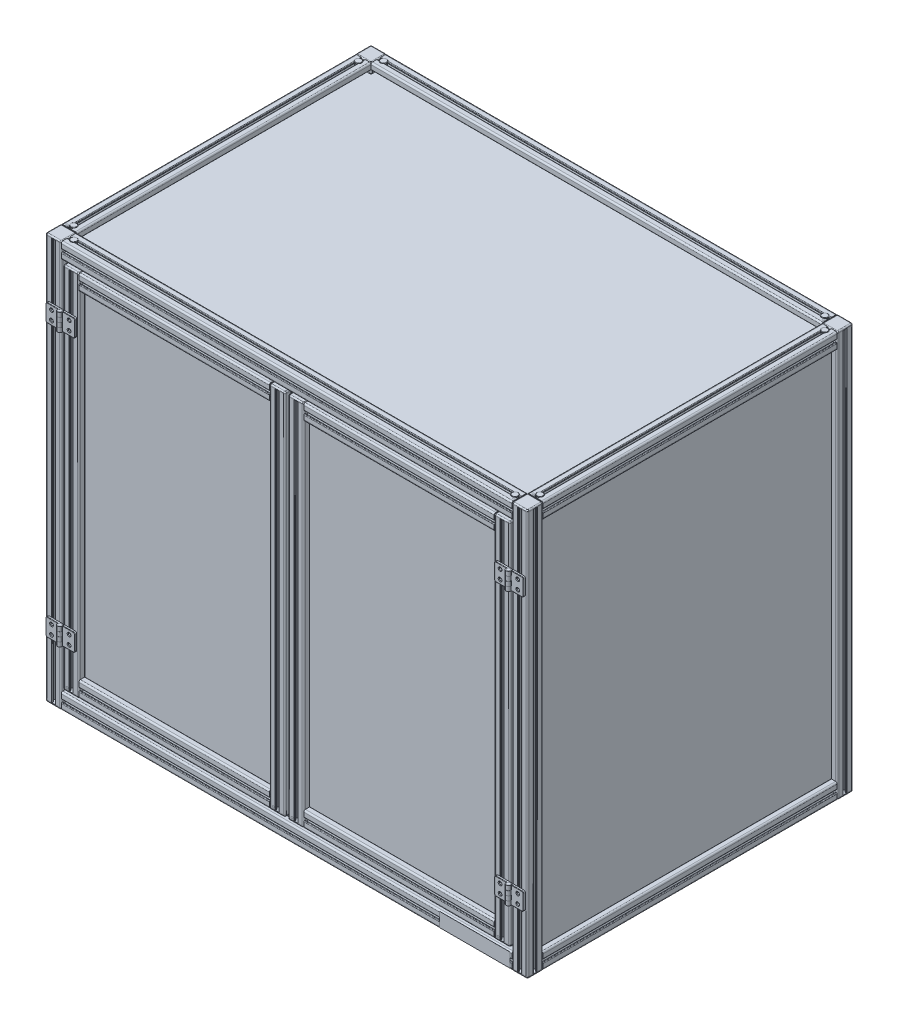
SolidWorks part; units mm, degrees
other "<202501-0001 _Schutzzaun Roboterzelle V2 D>-<202501-0001 _Schutzzaun Roboterzelle V2 D.STEP-1/Kopie (2) von Profil 8 40x40 leicht natur^SW049037_ZV-A _ ZV-A.STEP-1/Kopie von AS0041460^Kopie (2) von Pr"
other "<202501-0001 _Schutzzaun Roboterzelle V2 D>-<202501-0001 _Schutzzaun Roboterzelle V2 D.STEP-1/Kopie (2) von Profil 8 40x40 leicht natur^SW049037_ZV-A _ ZV-A.STEP-1/Kopie von AS0041460^Kopie (2) von Pr"
other "<202501-0001 _Schutzzaun Roboterzelle V2 D>-<202501-0001 _Schutzzaun Roboterzelle V2 D.STEP-1/Kopie (2) von Profil 8 40x40 leicht natur^SW049037_ZV-A _ ZV-A.STEP-1/Kopie von AS0041460^Kopie (2) von Pr"
other "<202501-0001 _Schutzzaun Roboterzelle V2 D>-<202501-0001 _Schutzzaun Roboterzelle V2 D.STEP-1/Kopie (2) von Profil 8 40x40 leicht natur^SW049037_ZV-A _ ZV-A.STEP-1/Kopie von AS0041460^Kopie (2) von Pr"
other "<202501-0001 _Schutzzaun Roboterzelle V2 D>-<202501-0001 _Schutzzaun Roboterzelle V2 D.STEP-1/Kopie (2) von Profil 8 40x40 leicht natur^SW049037_ZV-A _ ZV-A.STEP-1/Kopie von AS0041460^Kopie (2) von Pr"
other "<202501-0001 _Schutzzaun Roboterzelle V2 D>-<202501-0001 _Schutzzaun Roboterzelle V2 D.STEP-1/Kopie (2) von Profil 8 40x40 leicht natur^SW049037_ZV-A _ ZV-A.STEP-1/Profil 8 40x40 leicht natur^Kopie (2"
other "<202501-0001 _Schutzzaun Roboterzelle V2 D>-<202501-0001 _Schutzzaun Roboterzelle V2 D.STEP-1/Kopie von Profil 8 40x40 leicht natur^SW049037_-- _ --.STEP-4/Profil 8 40x40 leicht natur^Kopie von Profil"
other "<202501-0001 _Schutzzaun Roboterzelle V2 D>-<202501-0001 _Schutzzaun Roboterzelle V2 D.STEP-1/Kopie von Profil 8 40x40 leicht natur^SW049037_-- _ --.STEP-3/Profil 8 40x40 leicht natur^Kopie von Profil"
other "<202501-0001 _Schutzzaun Roboterzelle V2 D>-<202501-0001 _Schutzzaun Roboterzelle V2 D.STEP-1/Kopie von Profil 8 40x40 leicht natur^SW049037_-- _ --.STEP-2/Profil 8 40x40 leicht natur^Kopie von Profil"
other "<202501-0001 _Schutzzaun Roboterzelle V2 D>-<202501-0001 _Schutzzaun Roboterzelle V2 D.STEP-1/Kopie von Profil 8 40x40 leicht natur^SW049037_-- _ --.STEP-1/Profil 8 40x40 leicht natur^Kopie von Profil"
other "<202501-0001 _Schutzzaun Roboterzelle V2 D>-<202501-0001 _Schutzzaun Roboterzelle V2 D.STEP-1/Kopie (2) von Profil 8 40x40 leicht natur^SW049037_ZV-A _ ZV-A.STEP-3/Kopie von AS0041460^Kopie (2) von Pr"
other "<202501-0001 _Schutzzaun Roboterzelle V2 D>-<202501-0001 _Schutzzaun Roboterzelle V2 D.STEP-1/Kopie (2) von Profil 8 40x40 leicht natur^SW049037_ZV-A _ ZV-A.STEP-3/Kopie von AS0041460^Kopie (2) von Pr"
other "<202501-0001 _Schutzzaun Roboterzelle V2 D>-<202501-0001 _Schutzzaun Roboterzelle V2 D.STEP-1/Kopie (2) von Profil 8 40x40 leicht natur^SW049037_ZV-A _ ZV-A.STEP-3/Kopie von AS0041460^Kopie (2) von Pr"
other "<202501-0001 _Schutzzaun Roboterzelle V2 D>-<202501-0001 _Schutzzaun Roboterzelle V2 D.STEP-1/Kopie (2) von Profil 8 40x40 leicht natur^SW049037_ZV-A _ ZV-A.STEP-3/Profil 8 40x40 leicht natur^Kopie (2"
other "<202501-0001 _Schutzzaun Roboterzelle V2 D>-<202501-0001 _Schutzzaun Roboterzelle V2 D.STEP-1/Kopie (2) von Profil 8 40x40 leicht natur^SW049037_ZV-A _ ZV-A.STEP-2/Kopie von AS0041460^Kopie (2) von Pr"
other "<202501-0001 _Schutzzaun Roboterzelle V2 D>-<202501-0001 _Schutzzaun Roboterzelle V2 D.STEP-1/Kopie (2) von Profil 8 40x40 leicht natur^SW049037_ZV-A _ ZV-A.STEP-2/Kopie von AS0041460^Kopie (2) von Pr"
other "<202501-0001 _Schutzzaun Roboterzelle V2 D>-<202501-0001 _Schutzzaun Roboterzelle V2 D.STEP-1/Kopie (2) von Profil 8 40x40 leicht natur^SW049037_ZV-A _ ZV-A.STEP-2/Kopie von AS0041460^Kopie (2) von Pr"
other "<202501-0001 _Schutzzaun Roboterzelle V2 D>-<202501-0001 _Schutzzaun Roboterzelle V2 D.STEP-1/Kopie (2) von Profil 8 40x40 leicht natur^SW049037_ZV-A _ ZV-A.STEP-2/Kopie von AS0041460^Kopie (2) von Pr"
other "<202501-0001 _Schutzzaun Roboterzelle V2 D>-<202501-0001 _Schutzzaun Roboterzelle V2 D.STEP-1/Kopie (2) von Profil 8 40x40 leicht natur^SW049037_ZV-A _ ZV-A.STEP-2/Kopie von AS0041460^Kopie (2) von Pr"
other "<202501-0001 _Schutzzaun Roboterzelle V2 D>-<202501-0001 _Schutzzaun Roboterzelle V2 D.STEP-1/Kopie (2) von Profil 8 40x40 leicht natur^SW049037_ZV-A _ ZV-A.STEP-2/Kopie von AS0041460^Kopie (2) von Pr"
other "<202501-0001 _Schutzzaun Roboterzelle V2 D>-<202501-0001 _Schutzzaun Roboterzelle V2 D.STEP-1/Kopie (2) von Profil 8 40x40 leicht natur^SW049037_ZV-A _ ZV-A.STEP-2/Kopie von AS0041460^Kopie (2) von Pr"
other "<202501-0001 _Schutzzaun Roboterzelle V2 D>-<202501-0001 _Schutzzaun Roboterzelle V2 D.STEP-1/Kopie (2) von Profil 8 40x40 leicht natur^SW049037_ZV-A _ ZV-A.STEP-2/Kopie von AS0041460^Kopie (2) von Pr"
other "<202501-0001 _Schutzzaun Roboterzelle V2 D>-<202501-0001 _Schutzzaun Roboterzelle V2 D.STEP-1/Kopie (2) von Profil 8 40x40 leicht natur^SW049037_ZV-A _ ZV-A.STEP-2/Profil 8 40x40 leicht natur^Kopie (2"
other "<202501-0001 _Schutzzaun Roboterzelle V2 D>-<202501-0001 _Schutzzaun Roboterzelle V2 D.STEP-1/Kopie (2) von Profil 8 40x40 leicht natur^SW049037_ZV-A _ ZV-A.STEP-1/Kopie von AS0041460^Kopie (2) von Pr"
other "<202501-0001 _Schutzzaun Roboterzelle V2 D>-<202501-0001 _Schutzzaun Roboterzelle V2 D.STEP-1/Kopie (2) von Profil 8 40x40 leicht natur^SW049037_ZV-A _ ZV-A.STEP-1/Kopie von AS0041460^Kopie (2) von Pr"
other "<202501-0001 _Schutzzaun Roboterzelle V2 D>-<202501-0001 _Schutzzaun Roboterzelle V2 D.STEP-1/Kopie (2) von Profil 8 40x40 leicht natur^SW049037_ZV-A _ ZV-A.STEP-1/Kopie von AS0041460^Kopie (2) von Pr"
other "<202501-0001 _Schutzzaun Roboterzelle V2 D>-<202501-0001 _Schutzzaun Roboterzelle V2 D.STEP-1/Kopie (3) von Profil 8 40x40 leicht natur^SW049037_ZV-A _ ZV-A.STEP-1/Kopie von AS0041460^Kopie (3) von Pr"
other "<202501-0001 _Schutzzaun Roboterzelle V2 D>-<202501-0001 _Schutzzaun Roboterzelle V2 D.STEP-1/Kopie (3) von Profil 8 40x40 leicht natur^SW049037_ZV-A _ ZV-A.STEP-1/Profil 8 40x40 leicht natur^Kopie (3"
other "<202501-0001 _Schutzzaun Roboterzelle V2 D>-<202501-0001 _Schutzzaun Roboterzelle V2 D.STEP-1/Kopie (2) von Profil 8 40x40 leicht natur^SW049037_ZV-A _ ZV-A.STEP-4/Kopie von AS0041460^Kopie (2) von Pr"
other "<202501-0001 _Schutzzaun Roboterzelle V2 D>-<202501-0001 _Schutzzaun Roboterzelle V2 D.STEP-1/Kopie (2) von Profil 8 40x40 leicht natur^SW049037_ZV-A _ ZV-A.STEP-4/Kopie von AS0041460^Kopie (2) von Pr"
other "<202501-0001 _Schutzzaun Roboterzelle V2 D>-<202501-0001 _Schutzzaun Roboterzelle V2 D.STEP-1/Kopie (2) von Profil 8 40x40 leicht natur^SW049037_ZV-A _ ZV-A.STEP-4/Kopie von AS0041460^Kopie (2) von Pr"
other "<202501-0001 _Schutzzaun Roboterzelle V2 D>-<202501-0001 _Schutzzaun Roboterzelle V2 D.STEP-1/Kopie (2) von Profil 8 40x40 leicht natur^SW049037_ZV-A _ ZV-A.STEP-4/Kopie von AS0041460^Kopie (2) von Pr"
other "<202501-0001 _Schutzzaun Roboterzelle V2 D>-<202501-0001 _Schutzzaun Roboterzelle V2 D.STEP-1/Kopie (2) von Profil 8 40x40 leicht natur^SW049037_ZV-A _ ZV-A.STEP-4/Kopie von AS0041460^Kopie (2) von Pr"
other "<202501-0001 _Schutzzaun Roboterzelle V2 D>-<202501-0001 _Schutzzaun Roboterzelle V2 D.STEP-1/Kopie (2) von Profil 8 40x40 leicht natur^SW049037_ZV-A _ ZV-A.STEP-4/Kopie von AS0041460^Kopie (2) von Pr"
other "<202501-0001 _Schutzzaun Roboterzelle V2 D>-<202501-0001 _Schutzzaun Roboterzelle V2 D.STEP-1/Kopie (2) von Profil 8 40x40 leicht natur^SW049037_ZV-A _ ZV-A.STEP-4/Kopie von AS0041460^Kopie (2) von Pr"
other "<202501-0001 _Schutzzaun Roboterzelle V2 D>-<202501-0001 _Schutzzaun Roboterzelle V2 D.STEP-1/Kopie (2) von Profil 8 40x40 leicht natur^SW049037_ZV-A _ ZV-A.STEP-4/Kopie von AS0041460^Kopie (2) von Pr"
other "<202501-0001 _Schutzzaun Roboterzelle V2 D>-<202501-0001 _Schutzzaun Roboterzelle V2 D.STEP-1/Kopie (2) von Profil 8 40x40 leicht natur^SW049037_ZV-A _ ZV-A.STEP-4/Profil 8 40x40 leicht natur^Kopie (2"
other "<202501-0001 _Schutzzaun Roboterzelle V2 D>-<202501-0001 _Schutzzaun Roboterzelle V2 D.STEP-1/Kopie (2) von Profil 8 40x40 leicht natur^SW049037_ZV-A _ ZV-A.STEP-3/Kopie von AS0041460^Kopie (2) von Pr"
other "<202501-0001 _Schutzzaun Roboterzelle V2 D>-<202501-0001 _Schutzzaun Roboterzelle V2 D.STEP-1/Kopie (2) von Profil 8 40x40 leicht natur^SW049037_ZV-A _ ZV-A.STEP-3/Kopie von AS0041460^Kopie (2) von Pr"
other "<202501-0001 _Schutzzaun Roboterzelle V2 D>-<202501-0001 _Schutzzaun Roboterzelle V2 D.STEP-1/Kopie (2) von Profil 8 40x40 leicht natur^SW049037_ZV-A _ ZV-A.STEP-3/Kopie von AS0041460^Kopie (2) von Pr"
other "<202501-0001 _Schutzzaun Roboterzelle V2 D>-<202501-0001 _Schutzzaun Roboterzelle V2 D.STEP-1/Kopie (2) von Profil 8 40x40 leicht natur^SW049037_ZV-A _ ZV-A.STEP-3/Kopie von AS0041460^Kopie (2) von Pr"
other "<202501-0001 _Schutzzaun Roboterzelle V2 D>-<202501-0001 _Schutzzaun Roboterzelle V2 D.STEP-1/Kopie (2) von Profil 8 40x40 leicht natur^SW049037_ZV-A _ ZV-A.STEP-3/Kopie von AS0041460^Kopie (2) von Pr"
other "<202501-0001 _Schutzzaun Roboterzelle V2 D>-<202501-0001 _Schutzzaun Roboterzelle V2 D.STEP-1/Kopie (3) von Profil 8 40x40 leicht natur^SW049037_ZV-A _ ZV-A.STEP-2/Kopie von AS0041460^Kopie (3) von Pr"
other "<202501-0001 _Schutzzaun Roboterzelle V2 D>-<202501-0001 _Schutzzaun Roboterzelle V2 D.STEP-1/Kopie (3) von Profil 8 40x40 leicht natur^SW049037_ZV-A _ ZV-A.STEP-2/Kopie von AS0041460^Kopie (3) von Pr"
other "<202501-0001 _Schutzzaun Roboterzelle V2 D>-<202501-0001 _Schutzzaun Roboterzelle V2 D.STEP-1/Kopie (3) von Profil 8 40x40 leicht natur^SW049037_ZV-A _ ZV-A.STEP-2/Kopie von AS0041460^Kopie (3) von Pr"
other "<202501-0001 _Schutzzaun Roboterzelle V2 D>-<202501-0001 _Schutzzaun Roboterzelle V2 D.STEP-1/Kopie (3) von Profil 8 40x40 leicht natur^SW049037_ZV-A _ ZV-A.STEP-2/Kopie von AS0041460^Kopie (3) von Pr"
other "<202501-0001 _Schutzzaun Roboterzelle V2 D>-<202501-0001 _Schutzzaun Roboterzelle V2 D.STEP-1/Kopie (3) von Profil 8 40x40 leicht natur^SW049037_ZV-A _ ZV-A.STEP-2/Kopie von AS0041460^Kopie (3) von Pr"
other "<202501-0001 _Schutzzaun Roboterzelle V2 D>-<202501-0001 _Schutzzaun Roboterzelle V2 D.STEP-1/Kopie (3) von Profil 8 40x40 leicht natur^SW049037_ZV-A _ ZV-A.STEP-2/Kopie von AS0041460^Kopie (3) von Pr"
other "<202501-0001 _Schutzzaun Roboterzelle V2 D>-<202501-0001 _Schutzzaun Roboterzelle V2 D.STEP-1/Kopie (3) von Profil 8 40x40 leicht natur^SW049037_ZV-A _ ZV-A.STEP-2/Kopie von AS0041460^Kopie (3) von Pr"
other "<202501-0001 _Schutzzaun Roboterzelle V2 D>-<202501-0001 _Schutzzaun Roboterzelle V2 D.STEP-1/Kopie (3) von Profil 8 40x40 leicht natur^SW049037_ZV-A _ ZV-A.STEP-2/Kopie von AS0041460^Kopie (3) von Pr"
other "<202501-0001 _Schutzzaun Roboterzelle V2 D>-<202501-0001 _Schutzzaun Roboterzelle V2 D.STEP-1/Kopie (3) von Profil 8 40x40 leicht natur^SW049037_ZV-A _ ZV-A.STEP-2/Profil 8 40x40 leicht natur^Kopie (3"
other "<202501-0001 _Schutzzaun Roboterzelle V2 D>-<202501-0001 _Schutzzaun Roboterzelle V2 D.STEP-1/Kopie (3) von Profil 8 40x40 leicht natur^SW049037_ZV-A _ ZV-A.STEP-1/Kopie von AS0041460^Kopie (3) von Pr"
other "<202501-0001 _Schutzzaun Roboterzelle V2 D>-<202501-0001 _Schutzzaun Roboterzelle V2 D.STEP-1/Kopie (3) von Profil 8 40x40 leicht natur^SW049037_ZV-A _ ZV-A.STEP-1/Kopie von AS0041460^Kopie (3) von Pr"
other "<202501-0001 _Schutzzaun Roboterzelle V2 D>-<202501-0001 _Schutzzaun Roboterzelle V2 D.STEP-1/Kopie (3) von Profil 8 40x40 leicht natur^SW049037_ZV-A _ ZV-A.STEP-1/Kopie von AS0041460^Kopie (3) von Pr"
other "<202501-0001 _Schutzzaun Roboterzelle V2 D>-<202501-0001 _Schutzzaun Roboterzelle V2 D.STEP-1/Kopie (3) von Profil 8 40x40 leicht natur^SW049037_ZV-A _ ZV-A.STEP-1/Kopie von AS0041460^Kopie (3) von Pr"
other "<202501-0001 _Schutzzaun Roboterzelle V2 D>-<202501-0001 _Schutzzaun Roboterzelle V2 D.STEP-1/Kopie (3) von Profil 8 40x40 leicht natur^SW049037_ZV-A _ ZV-A.STEP-1/Kopie von AS0041460^Kopie (3) von Pr"
other "<202501-0001 _Schutzzaun Roboterzelle V2 D>-<202501-0001 _Schutzzaun Roboterzelle V2 D.STEP-1/Kopie (3) von Profil 8 40x40 leicht natur^SW049037_ZV-A _ ZV-A.STEP-1/Kopie von AS0041460^Kopie (3) von Pr"
other "<202501-0001 _Schutzzaun Roboterzelle V2 D>-<202501-0001 _Schutzzaun Roboterzelle V2 D.STEP-1/Kopie (3) von Profil 8 40x40 leicht natur^SW049037_ZV-A _ ZV-A.STEP-1/Kopie von AS0041460^Kopie (3) von Pr"
other "<202501-0001 _Schutzzaun Roboterzelle V2 D>-<202501-0001 _Schutzzaun Roboterzelle V2 D.STEP-1/Kopie (3) von Profil 8 40x40 leicht natur^SW049037_ZV-A _ ZV-A.STEP-4/Kopie von AS0041460^Kopie (3) von Pr"
other "<202501-0001 _Schutzzaun Roboterzelle V2 D>-<202501-0001 _Schutzzaun Roboterzelle V2 D.STEP-1/Kopie (3) von Profil 8 40x40 leicht natur^SW049037_ZV-A _ ZV-A.STEP-4/Kopie von AS0041460^Kopie (3) von Pr"
other "<202501-0001 _Schutzzaun Roboterzelle V2 D>-<202501-0001 _Schutzzaun Roboterzelle V2 D.STEP-1/Kopie (3) von Profil 8 40x40 leicht natur^SW049037_ZV-A _ ZV-A.STEP-4/Kopie von AS0041460^Kopie (3) von Pr"
other "<202501-0001 _Schutzzaun Roboterzelle V2 D>-<202501-0001 _Schutzzaun Roboterzelle V2 D.STEP-1/Kopie (3) von Profil 8 40x40 leicht natur^SW049037_ZV-A _ ZV-A.STEP-4/Kopie von AS0041460^Kopie (3) von Pr"
other "<202501-0001 _Schutzzaun Roboterzelle V2 D>-<202501-0001 _Schutzzaun Roboterzelle V2 D.STEP-1/Kopie (3) von Profil 8 40x40 leicht natur^SW049037_ZV-A _ ZV-A.STEP-4/Kopie von AS0041460^Kopie (3) von Pr"
other "<202501-0001 _Schutzzaun Roboterzelle V2 D>-<202501-0001 _Schutzzaun Roboterzelle V2 D.STEP-1/Kopie (3) von Profil 8 40x40 leicht natur^SW049037_ZV-A _ ZV-A.STEP-4/Kopie von AS0041460^Kopie (3) von Pr"
other "<202501-0001 _Schutzzaun Roboterzelle V2 D>-<202501-0001 _Schutzzaun Roboterzelle V2 D.STEP-1/Kopie (3) von Profil 8 40x40 leicht natur^SW049037_ZV-A _ ZV-A.STEP-4/Profil 8 40x40 leicht natur^Kopie (3"
other "<202501-0001 _Schutzzaun Roboterzelle V2 D>-<202501-0001 _Schutzzaun Roboterzelle V2 D.STEP-1/Kopie (3) von Profil 8 40x40 leicht natur^SW049037_ZV-A _ ZV-A.STEP-3/Kopie von AS0041460^Kopie (3) von Pr"
other "<202501-0001 _Schutzzaun Roboterzelle V2 D>-<202501-0001 _Schutzzaun Roboterzelle V2 D.STEP-1/Kopie (3) von Profil 8 40x40 leicht natur^SW049037_ZV-A _ ZV-A.STEP-3/Kopie von AS0041460^Kopie (3) von Pr"
other "<202501-0001 _Schutzzaun Roboterzelle V2 D>-<202501-0001 _Schutzzaun Roboterzelle V2 D.STEP-1/Kopie (3) von Profil 8 40x40 leicht natur^SW049037_ZV-A _ ZV-A.STEP-3/Kopie von AS0041460^Kopie (3) von Pr"
other "<202501-0001 _Schutzzaun Roboterzelle V2 D>-<202501-0001 _Schutzzaun Roboterzelle V2 D.STEP-1/Kopie (3) von Profil 8 40x40 leicht natur^SW049037_ZV-A _ ZV-A.STEP-3/Kopie von AS0041460^Kopie (3) von Pr"
other "<202501-0001 _Schutzzaun Roboterzelle V2 D>-<202501-0001 _Schutzzaun Roboterzelle V2 D.STEP-1/Kopie (3) von Profil 8 40x40 leicht natur^SW049037_ZV-A _ ZV-A.STEP-3/Kopie von AS0041460^Kopie (3) von Pr"
other "<202501-0001 _Schutzzaun Roboterzelle V2 D>-<202501-0001 _Schutzzaun Roboterzelle V2 D.STEP-1/Kopie (3) von Profil 8 40x40 leicht natur^SW049037_ZV-A _ ZV-A.STEP-3/Kopie von AS0041460^Kopie (3) von Pr"
other "<202501-0001 _Schutzzaun Roboterzelle V2 D>-<202501-0001 _Schutzzaun Roboterzelle V2 D.STEP-1/Kopie (3) von Profil 8 40x40 leicht natur^SW049037_ZV-A _ ZV-A.STEP-3/Kopie von AS0041460^Kopie (3) von Pr"
other "<202501-0001 _Schutzzaun Roboterzelle V2 D>-<202501-0001 _Schutzzaun Roboterzelle V2 D.STEP-1/Kopie (3) von Profil 8 40x40 leicht natur^SW049037_ZV-A _ ZV-A.STEP-3/Kopie von AS0041460^Kopie (3) von Pr"
other "<202501-0001 _Schutzzaun Roboterzelle V2 D>-<202501-0001 _Schutzzaun Roboterzelle V2 D.STEP-1/Kopie (3) von Profil 8 40x40 leicht natur^SW049037_ZV-A _ ZV-A.STEP-3/Profil 8 40x40 leicht natur^Kopie (3"
other "<202501-0001 _Schutzzaun Roboterzelle V2 D>-<202501-0001 _Schutzzaun Roboterzelle V2 D.STEP-1/Abdeckkappen_PB08 - 08 - 40x40 (40015) s.STEP-14/Abdeckkappen_PB08 - 08 - 40x40 (40015) s-0.STEP-1-solid1>"
other "<202501-0001 _Schutzzaun Roboterzelle V2 D>-<202501-0001 _Schutzzaun Roboterzelle V2 D.STEP-1/Abdeckkappen_PB08 - 08 - 40x40 (40015) s.STEP-13/Abdeckkappen_PB08 - 08 - 40x40 (40015) s-0.STEP-1-solid1>"
other "<202501-0001 _Schutzzaun Roboterzelle V2 D>-<202501-0001 _Schutzzaun Roboterzelle V2 D.STEP-1/Abdeckkappen_PB08 - 08 - 40x40 (40015) s.STEP-12/Abdeckkappen_PB08 - 08 - 40x40 (40015) s-0.STEP-1-solid1>"
other "<202501-0001 _Schutzzaun Roboterzelle V2 D>-<202501-0001 _Schutzzaun Roboterzelle V2 D.STEP-1/Abdeckkappen_PB08 - 08 - 40x40 (40015) s.STEP-11/Abdeckkappen_PB08 - 08 - 40x40 (40015) s-0.STEP-1-solid1>"
other "<202501-0001 _Schutzzaun Roboterzelle V2 D>-<202501-0001 _Schutzzaun Roboterzelle V2 D.STEP-1/Abdeckkappen_PB08 - 08 - 40x40 (40015) s.STEP-10/Abdeckkappen_PB08 - 08 - 40x40 (40015) s-0.STEP-1-solid1>"
other "<202501-0001 _Schutzzaun Roboterzelle V2 D>-<202501-0001 _Schutzzaun Roboterzelle V2 D.STEP-1/Abdeckkappen_PB08 - 08 - 40x40 (40015) s.STEP-9/Abdeckkappen_PB08 - 08 - 40x40 (40015) s-0.STEP-1-solid1>"
other "<202501-0001 _Schutzzaun Roboterzelle V2 D>-<202501-0001 _Schutzzaun Roboterzelle V2 D.STEP-1/Abdeckkappen_PB08 - 08 - 40x40 (40015) s.STEP-8/Abdeckkappen_PB08 - 08 - 40x40 (40015) s-0.STEP-1-solid1>"
other "<202501-0001 _Schutzzaun Roboterzelle V2 D>-<202501-0001 _Schutzzaun Roboterzelle V2 D.STEP-1/Abdeckkappen_PB08 - 08 - 40x40 (40015) s.STEP-7/Abdeckkappen_PB08 - 08 - 40x40 (40015) s-0.STEP-1-solid1>"
other "<202501-0001 _Schutzzaun Roboterzelle V2 D>-<202501-0001 _Schutzzaun Roboterzelle V2 D.STEP-1/Abdeckkappen_PB08 - 08 - 40x40 (40015) s.STEP-6/Abdeckkappen_PB08 - 08 - 40x40 (40015) s-0.STEP-1-solid1>"
other "<202501-0001 _Schutzzaun Roboterzelle V2 D>-<202501-0001 _Schutzzaun Roboterzelle V2 D.STEP-1/Abdeckkappen_PB08 - 08 - 40x40 (40015) s.STEP-5/Abdeckkappen_PB08 - 08 - 40x40 (40015) s-0.STEP-1-solid1>"
other "<202501-0001 _Schutzzaun Roboterzelle V2 D>-<202501-0001 _Schutzzaun Roboterzelle V2 D.STEP-1/Abdeckkappen_PB08 - 08 - 40x40 (40015) s.STEP-4/Abdeckkappen_PB08 - 08 - 40x40 (40015) s-0.STEP-1-solid1>"
other "<202501-0001 _Schutzzaun Roboterzelle V2 D>-<202501-0001 _Schutzzaun Roboterzelle V2 D.STEP-1/Abdeckkappen_PB08 - 08 - 40x40 (40015) s.STEP-3/Abdeckkappen_PB08 - 08 - 40x40 (40015) s-0.STEP-1-solid1>"
other "<202501-0001 _Schutzzaun Roboterzelle V2 D>-<202501-0001 _Schutzzaun Roboterzelle V2 D.STEP-1/Abdeckkappen_PB08 - 08 - 40x40 (40015) s.STEP-2/Abdeckkappen_PB08 - 08 - 40x40 (40015) s-0.STEP-1-solid1>"
other "<202501-0001 _Schutzzaun Roboterzelle V2 D>-<202501-0001 _Schutzzaun Roboterzelle V2 D.STEP-1/Abdeckkappen_PB08 - 08 - 40x40 (40015) s.STEP-1/Abdeckkappen_PB08 - 08 - 40x40 (40015) s-0.STEP-1-solid1>"
other "<202501-0001 _Schutzzaun Roboterzelle V2 D>-<202501-0001 _Schutzzaun Roboterzelle V2 D.STEP-1/Kopie (3) von Profil 8 40x40 leicht natur^SW049037_ZV-A _ ZV-A.STEP-4/Kopie von AS0041460^Kopie (3) von Pr"
other "<202501-0001 _Schutzzaun Roboterzelle V2 D>-<202501-0001 _Schutzzaun Roboterzelle V2 D.STEP-1/Kopie (3) von Profil 8 40x40 leicht natur^SW049037_ZV-A _ ZV-A.STEP-4/Kopie von AS0041460^Kopie (3) von Pr"
other "<202501-0001 _Schutzzaun Roboterzelle V2 D>-<202501-0001 _Schutzzaun Roboterzelle V2 D.STEP-1/Kopie (5) von Profil 8 40x40 leicht natur^SW049037_ZV-A _ ZV-A.STEP-2/Profil 8 40x40 leicht natur^Kopie (5"
other "<202501-0001 _Schutzzaun Roboterzelle V2 D>-<202501-0001 _Schutzzaun Roboterzelle V2 D.STEP-1/Kopie (5) von Profil 8 40x40 leicht natur^SW049037_ZV-A _ ZV-A.STEP-1/Kopie von AS0041460^Kopie (5) von Pr"
other "<202501-0001 _Schutzzaun Roboterzelle V2 D>-<202501-0001 _Schutzzaun Roboterzelle V2 D.STEP-1/Kopie (5) von Profil 8 40x40 leicht natur^SW049037_ZV-A _ ZV-A.STEP-1/Kopie von AS0041460^Kopie (5) von Pr"
other "<202501-0001 _Schutzzaun Roboterzelle V2 D>-<202501-0001 _Schutzzaun Roboterzelle V2 D.STEP-1/Kopie (5) von Profil 8 40x40 leicht natur^SW049037_ZV-A _ ZV-A.STEP-1/Kopie von AS0041460^Kopie (5) von Pr"
other "<202501-0001 _Schutzzaun Roboterzelle V2 D>-<202501-0001 _Schutzzaun Roboterzelle V2 D.STEP-1/Kopie (5) von Profil 8 40x40 leicht natur^SW049037_ZV-A _ ZV-A.STEP-1/Kopie von AS0041460^Kopie (5) von Pr"
other "<202501-0001 _Schutzzaun Roboterzelle V2 D>-<202501-0001 _Schutzzaun Roboterzelle V2 D.STEP-1/Kopie (5) von Profil 8 40x40 leicht natur^SW049037_ZV-A _ ZV-A.STEP-1/Kopie von AS0041460^Kopie (5) von Pr"
other "<202501-0001 _Schutzzaun Roboterzelle V2 D>-<202501-0001 _Schutzzaun Roboterzelle V2 D.STEP-1/Kopie (5) von Profil 8 40x40 leicht natur^SW049037_ZV-A _ ZV-A.STEP-1/Kopie von AS0041460^Kopie (5) von Pr"
other "<202501-0001 _Schutzzaun Roboterzelle V2 D>-<202501-0001 _Schutzzaun Roboterzelle V2 D.STEP-1/Kopie (5) von Profil 8 40x40 leicht natur^SW049037_ZV-A _ ZV-A.STEP-1/Kopie von AS0041460^Kopie (5) von Pr"
other "<202501-0001 _Schutzzaun Roboterzelle V2 D>-<202501-0001 _Schutzzaun Roboterzelle V2 D.STEP-1/Kopie (5) von Profil 8 40x40 leicht natur^SW049037_ZV-A _ ZV-A.STEP-1/Kopie von AS0041460^Kopie (5) von Pr"
other "<202501-0001 _Schutzzaun Roboterzelle V2 D>-<202501-0001 _Schutzzaun Roboterzelle V2 D.STEP-1/Kopie (5) von Profil 8 40x40 leicht natur^SW049037_ZV-A _ ZV-A.STEP-1/Profil 8 40x40 leicht natur^Kopie (5"
other "<202501-0001 _Schutzzaun Roboterzelle V2 D>-<202501-0001 _Schutzzaun Roboterzelle V2 D.STEP-1/Kopie (4) von Profil 8 40x40 leicht natur^SW049037_-- _ --.STEP-4/Profil 8 40x40 leicht natur^Kopie (4) vo"
other "<202501-0001 _Schutzzaun Roboterzelle V2 D>-<202501-0001 _Schutzzaun Roboterzelle V2 D.STEP-1/Kopie (4) von Profil 8 40x40 leicht natur^SW049037_-- _ --.STEP-3/Profil 8 40x40 leicht natur^Kopie (4) vo"
other "<202501-0001 _Schutzzaun Roboterzelle V2 D>-<202501-0001 _Schutzzaun Roboterzelle V2 D.STEP-1/Kopie (4) von Profil 8 40x40 leicht natur^SW049037_-- _ --.STEP-2/Profil 8 40x40 leicht natur^Kopie (4) vo"
other "<202501-0001 _Schutzzaun Roboterzelle V2 D>-<202501-0001 _Schutzzaun Roboterzelle V2 D.STEP-1/Kopie (4) von Profil 8 40x40 leicht natur^SW049037_-- _ --.STEP-1/Profil 8 40x40 leicht natur^Kopie (4) vo"
other "<202501-0001 _Schutzzaun Roboterzelle V2 D>-<202501-0001 _Schutzzaun Roboterzelle V2 D.STEP-1/Abdeckkappen_PB08 - 08 - 40x40 (40015) s.STEP-16/Abdeckkappen_PB08 - 08 - 40x40 (40015) s-0.STEP-1-solid1>"
other "<202501-0001 _Schutzzaun Roboterzelle V2 D>-<202501-0001 _Schutzzaun Roboterzelle V2 D.STEP-1/Abdeckkappen_PB08 - 08 - 40x40 (40015) s.STEP-15/Abdeckkappen_PB08 - 08 - 40x40 (40015) s-0.STEP-1-solid1>"
other "<202501-0001 _Schutzzaun Roboterzelle V2 D>-<202501-0001 _Schutzzaun Roboterzelle V2 D.STEP-1/Kopie (5) von Profil 8 40x40 leicht natur^SW049037_ZV-A _ ZV-A.STEP-3/Kopie von AS0041460^Kopie (5) von Pr"
other "<202501-0001 _Schutzzaun Roboterzelle V2 D>-<202501-0001 _Schutzzaun Roboterzelle V2 D.STEP-1/Kopie (5) von Profil 8 40x40 leicht natur^SW049037_ZV-A _ ZV-A.STEP-3/Kopie von AS0041460^Kopie (5) von Pr"
other "<202501-0001 _Schutzzaun Roboterzelle V2 D>-<202501-0001 _Schutzzaun Roboterzelle V2 D.STEP-1/Kopie (5) von Profil 8 40x40 leicht natur^SW049037_ZV-A _ ZV-A.STEP-3/Kopie von AS0041460^Kopie (5) von Pr"
other "<202501-0001 _Schutzzaun Roboterzelle V2 D>-<202501-0001 _Schutzzaun Roboterzelle V2 D.STEP-1/Kopie (5) von Profil 8 40x40 leicht natur^SW049037_ZV-A _ ZV-A.STEP-3/Kopie von AS0041460^Kopie (5) von Pr"
other "<202501-0001 _Schutzzaun Roboterzelle V2 D>-<202501-0001 _Schutzzaun Roboterzelle V2 D.STEP-1/Kopie (5) von Profil 8 40x40 leicht natur^SW049037_ZV-A _ ZV-A.STEP-3/Kopie von AS0041460^Kopie (5) von Pr"
other "<202501-0001 _Schutzzaun Roboterzelle V2 D>-<202501-0001 _Schutzzaun Roboterzelle V2 D.STEP-1/Kopie (5) von Profil 8 40x40 leicht natur^SW049037_ZV-A _ ZV-A.STEP-3/Kopie von AS0041460^Kopie (5) von Pr"
other "<202501-0001 _Schutzzaun Roboterzelle V2 D>-<202501-0001 _Schutzzaun Roboterzelle V2 D.STEP-1/Kopie (5) von Profil 8 40x40 leicht natur^SW049037_ZV-A _ ZV-A.STEP-3/Kopie von AS0041460^Kopie (5) von Pr"
other "<202501-0001 _Schutzzaun Roboterzelle V2 D>-<202501-0001 _Schutzzaun Roboterzelle V2 D.STEP-1/Kopie (5) von Profil 8 40x40 leicht natur^SW049037_ZV-A _ ZV-A.STEP-3/Profil 8 40x40 leicht natur^Kopie (5"
other "<202501-0001 _Schutzzaun Roboterzelle V2 D>-<202501-0001 _Schutzzaun Roboterzelle V2 D.STEP-1/Kopie (5) von Profil 8 40x40 leicht natur^SW049037_ZV-A _ ZV-A.STEP-2/Kopie von AS0041460^Kopie (5) von Pr"
other "<202501-0001 _Schutzzaun Roboterzelle V2 D>-<202501-0001 _Schutzzaun Roboterzelle V2 D.STEP-1/Kopie (5) von Profil 8 40x40 leicht natur^SW049037_ZV-A _ ZV-A.STEP-2/Kopie von AS0041460^Kopie (5) von Pr"
other "<202501-0001 _Schutzzaun Roboterzelle V2 D>-<202501-0001 _Schutzzaun Roboterzelle V2 D.STEP-1/Kopie (5) von Profil 8 40x40 leicht natur^SW049037_ZV-A _ ZV-A.STEP-2/Kopie von AS0041460^Kopie (5) von Pr"
other "<202501-0001 _Schutzzaun Roboterzelle V2 D>-<202501-0001 _Schutzzaun Roboterzelle V2 D.STEP-1/Kopie (5) von Profil 8 40x40 leicht natur^SW049037_ZV-A _ ZV-A.STEP-2/Kopie von AS0041460^Kopie (5) von Pr"
other "<202501-0001 _Schutzzaun Roboterzelle V2 D>-<202501-0001 _Schutzzaun Roboterzelle V2 D.STEP-1/Kopie (5) von Profil 8 40x40 leicht natur^SW049037_ZV-A _ ZV-A.STEP-2/Kopie von AS0041460^Kopie (5) von Pr"
other "<202501-0001 _Schutzzaun Roboterzelle V2 D>-<202501-0001 _Schutzzaun Roboterzelle V2 D.STEP-1/Kopie (5) von Profil 8 40x40 leicht natur^SW049037_ZV-A _ ZV-A.STEP-2/Kopie von AS0041460^Kopie (5) von Pr"
other "<202501-0001 _Schutzzaun Roboterzelle V2 D>-<202501-0001 _Schutzzaun Roboterzelle V2 D.STEP-1/Kopie (5) von Profil 8 40x40 leicht natur^SW049037_ZV-A _ ZV-A.STEP-2/Kopie von AS0041460^Kopie (5) von Pr"
other "<202501-0001 _Schutzzaun Roboterzelle V2 D>-<202501-0001 _Schutzzaun Roboterzelle V2 D.STEP-1/Kopie (5) von Profil 8 40x40 leicht natur^SW049037_ZV-A _ ZV-A.STEP-2/Kopie von AS0041460^Kopie (5) von Pr"
other "<202501-0001 _Schutzzaun Roboterzelle V2 D>-<202501-0001 _Schutzzaun Roboterzelle V2 D.STEP-1/AS0013820.STEP-1/AS0013820_02.STEP-1-solid1>"
other "<202501-0001 _Schutzzaun Roboterzelle V2 D>-<202501-0001 _Schutzzaun Roboterzelle V2 D.STEP-1/AS0013820.STEP-1/AS0013820_01.STEP-1-solid1>"
other "<202501-0001 _Schutzzaun Roboterzelle V2 D>-<202501-0001 _Schutzzaun Roboterzelle V2 D.STEP-1/Universalwinkel_ohne Befestigungssatz.STEP-4/Universalwinkelsaetze_Universalwinkel ESD.STEP-1-solid1>"
other "<202501-0001 _Schutzzaun Roboterzelle V2 D>-<202501-0001 _Schutzzaun Roboterzelle V2 D.STEP-1/Universalwinkel_ohne Befestigungssatz.STEP-3/Universalwinkelsaetze_Universalwinkel ESD.STEP-1-solid1>"
other "<202501-0001 _Schutzzaun Roboterzelle V2 D>-<202501-0001 _Schutzzaun Roboterzelle V2 D.STEP-1/Universalwinkel_ohne Befestigungssatz.STEP-2/Universalwinkelsaetze_Universalwinkel ESD.STEP-1-solid1>"
other "<202501-0001 _Schutzzaun Roboterzelle V2 D>-<202501-0001 _Schutzzaun Roboterzelle V2 D.STEP-1/Universalwinkel_ohne Befestigungssatz.STEP-1/Universalwinkelsaetze_Universalwinkel ESD.STEP-1-solid1>"
other "<202501-0001 _Schutzzaun Roboterzelle V2 D>-<202501-0001 _Schutzzaun Roboterzelle V2 D.STEP-1/Kopie (5) von Profil 8 40x40 leicht natur^SW049037_ZV-A _ ZV-A.STEP-4/Kopie von AS0041460^Kopie (5) von Pr"
other "<202501-0001 _Schutzzaun Roboterzelle V2 D>-<202501-0001 _Schutzzaun Roboterzelle V2 D.STEP-1/Kopie (5) von Profil 8 40x40 leicht natur^SW049037_ZV-A _ ZV-A.STEP-4/Kopie von AS0041460^Kopie (5) von Pr"
other "<202501-0001 _Schutzzaun Roboterzelle V2 D>-<202501-0001 _Schutzzaun Roboterzelle V2 D.STEP-1/Kopie (5) von Profil 8 40x40 leicht natur^SW049037_ZV-A _ ZV-A.STEP-4/Kopie von AS0041460^Kopie (5) von Pr"
other "<202501-0001 _Schutzzaun Roboterzelle V2 D>-<202501-0001 _Schutzzaun Roboterzelle V2 D.STEP-1/Kopie (5) von Profil 8 40x40 leicht natur^SW049037_ZV-A _ ZV-A.STEP-4/Kopie von AS0041460^Kopie (5) von Pr"
other "<202501-0001 _Schutzzaun Roboterzelle V2 D>-<202501-0001 _Schutzzaun Roboterzelle V2 D.STEP-1/Kopie (5) von Profil 8 40x40 leicht natur^SW049037_ZV-A _ ZV-A.STEP-4/Kopie von AS0041460^Kopie (5) von Pr"
other "<202501-0001 _Schutzzaun Roboterzelle V2 D>-<202501-0001 _Schutzzaun Roboterzelle V2 D.STEP-1/Kopie (5) von Profil 8 40x40 leicht natur^SW049037_ZV-A _ ZV-A.STEP-4/Kopie von AS0041460^Kopie (5) von Pr"
other "<202501-0001 _Schutzzaun Roboterzelle V2 D>-<202501-0001 _Schutzzaun Roboterzelle V2 D.STEP-1/Kopie (5) von Profil 8 40x40 leicht natur^SW049037_ZV-A _ ZV-A.STEP-4/Kopie von AS0041460^Kopie (5) von Pr"
other "<202501-0001 _Schutzzaun Roboterzelle V2 D>-<202501-0001 _Schutzzaun Roboterzelle V2 D.STEP-1/Kopie (5) von Profil 8 40x40 leicht natur^SW049037_ZV-A _ ZV-A.STEP-4/Kopie von AS0041460^Kopie (5) von Pr"
other "<202501-0001 _Schutzzaun Roboterzelle V2 D>-<202501-0001 _Schutzzaun Roboterzelle V2 D.STEP-1/Kopie (5) von Profil 8 40x40 leicht natur^SW049037_ZV-A _ ZV-A.STEP-4/Profil 8 40x40 leicht natur^Kopie (5"
other "<202501-0001 _Schutzzaun Roboterzelle V2 D>-<202501-0001 _Schutzzaun Roboterzelle V2 D.STEP-1/Kopie (5) von Profil 8 40x40 leicht natur^SW049037_ZV-A _ ZV-A.STEP-3/Kopie von AS0041460^Kopie (5) von Pr"
other "<202501-0001 _Schutzzaun Roboterzelle V2 D>-<202501-0001 _Schutzzaun Roboterzelle V2 D.STEP-1/SW049039_HPL - 05.STEP-1-solid1>"
other "<202501-0001 _Schutzzaun Roboterzelle V2 D>-<202501-0001 _Schutzzaun Roboterzelle V2 D.STEP-1/SW049038_HPL - 05.STEP-2-solid1>"
other "<202501-0001 _Schutzzaun Roboterzelle V2 D>-<202501-0001 _Schutzzaun Roboterzelle V2 D.STEP-1/SW049038_HPL - 05.STEP-1-solid1>"
other "<202501-0001 _Schutzzaun Roboterzelle V2 D>-<202501-0001 _Schutzzaun Roboterzelle V2 D.STEP-1/Kugelschnaepper.STEP-2-solid1>"
other "<202501-0001 _Schutzzaun Roboterzelle V2 D>-<202501-0001 _Schutzzaun Roboterzelle V2 D.STEP-1/Kugelschnaepper.STEP-1-solid1>"
other "<202501-0001 _Schutzzaun Roboterzelle V2 D>-<202501-0001 _Schutzzaun Roboterzelle V2 D.STEP-1/Typenschild-Aufkleber_Normal.STEP-1/Typenschild-Aufkleber_Typenschild.STEP-1-solid1>"
other "<202501-0001 _Schutzzaun Roboterzelle V2 D>-<202501-0001 _Schutzzaun Roboterzelle V2 D.STEP-1/AS0013820.STEP-4/AS0013820_02.STEP-2-solid1>"
other "<202501-0001 _Schutzzaun Roboterzelle V2 D>-<202501-0001 _Schutzzaun Roboterzelle V2 D.STEP-1/AS0013820.STEP-4/AS0013820_02.STEP-1-solid1>"
other "<202501-0001 _Schutzzaun Roboterzelle V2 D>-<202501-0001 _Schutzzaun Roboterzelle V2 D.STEP-1/AS0013820.STEP-4/AS0013820_01.STEP-1-solid1>"
other "<202501-0001 _Schutzzaun Roboterzelle V2 D>-<202501-0001 _Schutzzaun Roboterzelle V2 D.STEP-1/AS0013820.STEP-3/AS0013820_02.STEP-2-solid1>"
other "<202501-0001 _Schutzzaun Roboterzelle V2 D>-<202501-0001 _Schutzzaun Roboterzelle V2 D.STEP-1/AS0013820.STEP-3/AS0013820_02.STEP-1-solid1>"
other "<202501-0001 _Schutzzaun Roboterzelle V2 D>-<202501-0001 _Schutzzaun Roboterzelle V2 D.STEP-1/AS0013820.STEP-3/AS0013820_01.STEP-1-solid1>"
other "<202501-0001 _Schutzzaun Roboterzelle V2 D>-<202501-0001 _Schutzzaun Roboterzelle V2 D.STEP-1/AS0013820.STEP-2/AS0013820_02.STEP-2-solid1>"
other "<202501-0001 _Schutzzaun Roboterzelle V2 D>-<202501-0001 _Schutzzaun Roboterzelle V2 D.STEP-1/AS0013820.STEP-2/AS0013820_02.STEP-1-solid1>"
other "<202501-0001 _Schutzzaun Roboterzelle V2 D>-<202501-0001 _Schutzzaun Roboterzelle V2 D.STEP-1/AS0013820.STEP-2/AS0013820_01.STEP-1-solid1>"
other "<202501-0001 _Schutzzaun Roboterzelle V2 D>-<202501-0001 _Schutzzaun Roboterzelle V2 D.STEP-1/AS0013820.STEP-1/AS0013820_02.STEP-2-solid1>"
other "<202501-0001 _Schutzzaun Roboterzelle V2 D>-<202501-0001 _Schutzzaun Roboterzelle V2 D.STEP-1/SW049041_HPL - 05.STEP-1-solid1>"
other "<202501-0001 _Schutzzaun Roboterzelle V2 D>-<202501-0001 _Schutzzaun Roboterzelle V2 D.STEP-1/SW049040_HPL - 05.STEP-2-solid1>"
other "<202501-0001 _Schutzzaun Roboterzelle V2 D>-<202501-0001 _Schutzzaun Roboterzelle V2 D.STEP-1/SW049040_HPL - 05.STEP-1-solid1>"
ref_plane "Ebene vorne" through (0, 0, 0) normal (0, 0, 1) x (1, 0, 0)
ref_plane "Ebene oben" through (0, 0, 0) normal (0, 1, 0) x (1, 0, 0)
ref_plane "Ebene rechts" through (0, 0, 0) normal (1, 0, 0) x (0, 0, -1)
imported_body "Kopie von Profil 8 40x40 leicht natur^SW049037_-- _ ---1/Profil 8 40x40 leicht natur^Kopie von Profil 8 40x40 leicht natur_SW049037_--_---1-solid1"
imported_body "Kopie von Profil 8 40x40 leicht natur^SW049037_-- _ ---2/Profil 8 40x40 leicht natur^Kopie von Profil 8 40x40 leicht natur_SW049037_--_---1-solid1"
imported_body "Kopie von Profil 8 40x40 leicht natur^SW049037_-- _ ---3/Profil 8 40x40 leicht natur^Kopie von Profil 8 40x40 leicht natur_SW049037_--_---1-solid1"
imported_body "Kopie von Profil 8 40x40 leicht natur^SW049037_-- _ ---4/Profil 8 40x40 leicht natur^Kopie von Profil 8 40x40 leicht natur_SW049037_--_---1-solid1"
imported_body "Kopie (2) von Profil 8 40x40 leicht natur^SW049037_A-A _ A-A-1/Profil 8 40x40 leicht natur^Kopie (2) von Profil 8 40x40 leicht natur_SW049037_A-A _ A-A-1-solid1"
imported_body "Kopie (2) von Profil 8 40x40 leicht natur^SW049037_A-A _ A-A-1/Kopie von Automatikverbinder^Kopie (2) von Profil 8 40x40 leicht natur_SW049037_PB 8 - Nut 8-1/Kopie von Automatikverbinder Huelse^Kopie "
imported_body "Kopie (2) von Profil 8 40x40 leicht natur^SW049037_A-A _ A-A-1/Kopie von Automatikverbinder^Kopie (2) von Profil 8 40x40 leicht natur_SW049037_PB 8 - Nut 8-1/Automatikverbinder Schraube^Kopie von Auto"
imported_body "Kopie (2) von Profil 8 40x40 leicht natur^SW049037_A-A _ A-A-1/Kopie von Automatikverbinder^Kopie (2) von Profil 8 40x40 leicht natur_SW049037_PB 8 - Nut 8-1/Automatikverbinder Nutenstein^Kopie von Au"
imported_body "Kopie (2) von Profil 8 40x40 leicht natur^SW049037_A-A _ A-A-1/Kopie von Automatikverbinder^Kopie (2) von Profil 8 40x40 leicht natur_SW049037_PB 8 - Nut 8-2/Kopie von Automatikverbinder Huelse^Kopie "
imported_body "Kopie (2) von Profil 8 40x40 leicht natur^SW049037_A-A _ A-A-1/Kopie von Automatikverbinder^Kopie (2) von Profil 8 40x40 leicht natur_SW049037_PB 8 - Nut 8-2/Automatikverbinder Schraube^Kopie von Auto"
imported_body "Kopie (2) von Profil 8 40x40 leicht natur^SW049037_A-A _ A-A-1/Kopie von Automatikverbinder^Kopie (2) von Profil 8 40x40 leicht natur_SW049037_PB 8 - Nut 8-2/Automatikverbinder Nutenstein^Kopie von Au"
imported_body "Kopie (2) von Profil 8 40x40 leicht natur^SW049037_A-A _ A-A-2/Profil 8 40x40 leicht natur^Kopie (2) von Profil 8 40x40 leicht natur_SW049037_A-A _ A-A-1-solid1"
imported_body "Kopie (2) von Profil 8 40x40 leicht natur^SW049037_A-A _ A-A-2/Kopie von Automatikverbinder^Kopie (2) von Profil 8 40x40 leicht natur_SW049037_PB 8 - Nut 8-1/Kopie von Automatikverbinder Huelse^Kopie "
imported_body "Kopie (2) von Profil 8 40x40 leicht natur^SW049037_A-A _ A-A-2/Kopie von Automatikverbinder^Kopie (2) von Profil 8 40x40 leicht natur_SW049037_PB 8 - Nut 8-1/Automatikverbinder Schraube^Kopie von Auto"
imported_body "Kopie (2) von Profil 8 40x40 leicht natur^SW049037_A-A _ A-A-2/Kopie von Automatikverbinder^Kopie (2) von Profil 8 40x40 leicht natur_SW049037_PB 8 - Nut 8-1/Automatikverbinder Nutenstein^Kopie von Au"
imported_body "Kopie (2) von Profil 8 40x40 leicht natur^SW049037_A-A _ A-A-2/Kopie von Automatikverbinder^Kopie (2) von Profil 8 40x40 leicht natur_SW049037_PB 8 - Nut 8-2/Kopie von Automatikverbinder Huelse^Kopie "
imported_body "Kopie (2) von Profil 8 40x40 leicht natur^SW049037_A-A _ A-A-2/Kopie von Automatikverbinder^Kopie (2) von Profil 8 40x40 leicht natur_SW049037_PB 8 - Nut 8-2/Automatikverbinder Schraube^Kopie von Auto"
imported_body "Kopie (2) von Profil 8 40x40 leicht natur^SW049037_A-A _ A-A-2/Kopie von Automatikverbinder^Kopie (2) von Profil 8 40x40 leicht natur_SW049037_PB 8 - Nut 8-2/Automatikverbinder Nutenstein^Kopie von Au"
imported_body "Kopie (2) von Profil 8 40x40 leicht natur^SW049037_A-A _ A-A-3/Profil 8 40x40 leicht natur^Kopie (2) von Profil 8 40x40 leicht natur_SW049037_A-A _ A-A-1-solid1"
imported_body "Kopie (2) von Profil 8 40x40 leicht natur^SW049037_A-A _ A-A-3/Kopie von Automatikverbinder^Kopie (2) von Profil 8 40x40 leicht natur_SW049037_PB 8 - Nut 8-1/Kopie von Automatikverbinder Huelse^Kopie "
imported_body "Kopie (2) von Profil 8 40x40 leicht natur^SW049037_A-A _ A-A-3/Kopie von Automatikverbinder^Kopie (2) von Profil 8 40x40 leicht natur_SW049037_PB 8 - Nut 8-1/Automatikverbinder Schraube^Kopie von Auto"
imported_body "Kopie (2) von Profil 8 40x40 leicht natur^SW049037_A-A _ A-A-3/Kopie von Automatikverbinder^Kopie (2) von Profil 8 40x40 leicht natur_SW049037_PB 8 - Nut 8-1/Automatikverbinder Nutenstein^Kopie von Au"
imported_body "Kopie (2) von Profil 8 40x40 leicht natur^SW049037_A-A _ A-A-3/Kopie von Automatikverbinder^Kopie (2) von Profil 8 40x40 leicht natur_SW049037_PB 8 - Nut 8-2/Kopie von Automatikverbinder Huelse^Kopie "
imported_body "Kopie (2) von Profil 8 40x40 leicht natur^SW049037_A-A _ A-A-3/Kopie von Automatikverbinder^Kopie (2) von Profil 8 40x40 leicht natur_SW049037_PB 8 - Nut 8-2/Automatikverbinder Schraube^Kopie von Auto"
imported_body "Kopie (2) von Profil 8 40x40 leicht natur^SW049037_A-A _ A-A-3/Kopie von Automatikverbinder^Kopie (2) von Profil 8 40x40 leicht natur_SW049037_PB 8 - Nut 8-2/Automatikverbinder Nutenstein^Kopie von Au"
imported_body "Kopie (2) von Profil 8 40x40 leicht natur^SW049037_A-A _ A-A-4/Profil 8 40x40 leicht natur^Kopie (2) von Profil 8 40x40 leicht natur_SW049037_A-A _ A-A-1-solid1"
imported_body "Kopie (2) von Profil 8 40x40 leicht natur^SW049037_A-A _ A-A-4/Kopie von Automatikverbinder^Kopie (2) von Profil 8 40x40 leicht natur_SW049037_PB 8 - Nut 8-1/Kopie von Automatikverbinder Huelse^Kopie "
imported_body "Kopie (2) von Profil 8 40x40 leicht natur^SW049037_A-A _ A-A-4/Kopie von Automatikverbinder^Kopie (2) von Profil 8 40x40 leicht natur_SW049037_PB 8 - Nut 8-1/Automatikverbinder Schraube^Kopie von Auto"
imported_body "Kopie (2) von Profil 8 40x40 leicht natur^SW049037_A-A _ A-A-4/Kopie von Automatikverbinder^Kopie (2) von Profil 8 40x40 leicht natur_SW049037_PB 8 - Nut 8-1/Automatikverbinder Nutenstein^Kopie von Au"
imported_body "Kopie (2) von Profil 8 40x40 leicht natur^SW049037_A-A _ A-A-4/Kopie von Automatikverbinder^Kopie (2) von Profil 8 40x40 leicht natur_SW049037_PB 8 - Nut 8-2/Kopie von Automatikverbinder Huelse^Kopie "
imported_body "Kopie (2) von Profil 8 40x40 leicht natur^SW049037_A-A _ A-A-4/Kopie von Automatikverbinder^Kopie (2) von Profil 8 40x40 leicht natur_SW049037_PB 8 - Nut 8-2/Automatikverbinder Schraube^Kopie von Auto"
imported_body "Kopie (2) von Profil 8 40x40 leicht natur^SW049037_A-A _ A-A-4/Kopie von Automatikverbinder^Kopie (2) von Profil 8 40x40 leicht natur_SW049037_PB 8 - Nut 8-2/Automatikverbinder Nutenstein^Kopie von Au"
imported_body "Kopie (3) von Profil 8 40x40 leicht natur^SW049037_A-A _ A-A-1/Profil 8 40x40 leicht natur^Kopie (3) von Profil 8 40x40 leicht natur_SW049037_A-A _ A-A-1-solid1"
imported_body "Kopie (3) von Profil 8 40x40 leicht natur^SW049037_A-A _ A-A-1/Kopie von Automatikverbinder^Kopie (3) von Profil 8 40x40 leicht natur_SW049037_PB 8 - Nut 8-1/Kopie von Automatikverbinder Huelse^Kopie "
imported_body "Kopie (3) von Profil 8 40x40 leicht natur^SW049037_A-A _ A-A-1/Kopie von Automatikverbinder^Kopie (3) von Profil 8 40x40 leicht natur_SW049037_PB 8 - Nut 8-1/Automatikverbinder Schraube^Kopie von Auto"
imported_body "Kopie (3) von Profil 8 40x40 leicht natur^SW049037_A-A _ A-A-1/Kopie von Automatikverbinder^Kopie (3) von Profil 8 40x40 leicht natur_SW049037_PB 8 - Nut 8-1/Automatikverbinder Nutenstein^Kopie von Au"
imported_body "Kopie (3) von Profil 8 40x40 leicht natur^SW049037_A-A _ A-A-1/Kopie von Automatikverbinder^Kopie (3) von Profil 8 40x40 leicht natur_SW049037_PB 8 - Nut 8-2/Kopie von Automatikverbinder Huelse^Kopie "
imported_body "Kopie (3) von Profil 8 40x40 leicht natur^SW049037_A-A _ A-A-1/Kopie von Automatikverbinder^Kopie (3) von Profil 8 40x40 leicht natur_SW049037_PB 8 - Nut 8-2/Automatikverbinder Schraube^Kopie von Auto"
imported_body "Kopie (3) von Profil 8 40x40 leicht natur^SW049037_A-A _ A-A-1/Kopie von Automatikverbinder^Kopie (3) von Profil 8 40x40 leicht natur_SW049037_PB 8 - Nut 8-2/Automatikverbinder Nutenstein^Kopie von Au"
imported_body "Kopie (3) von Profil 8 40x40 leicht natur^SW049037_A-A _ A-A-2/Profil 8 40x40 leicht natur^Kopie (3) von Profil 8 40x40 leicht natur_SW049037_A-A _ A-A-1-solid1"
imported_body "Kopie (3) von Profil 8 40x40 leicht natur^SW049037_A-A _ A-A-2/Kopie von Automatikverbinder^Kopie (3) von Profil 8 40x40 leicht natur_SW049037_PB 8 - Nut 8-1/Kopie von Automatikverbinder Huelse^Kopie "
imported_body "Kopie (3) von Profil 8 40x40 leicht natur^SW049037_A-A _ A-A-2/Kopie von Automatikverbinder^Kopie (3) von Profil 8 40x40 leicht natur_SW049037_PB 8 - Nut 8-1/Automatikverbinder Schraube^Kopie von Auto"
imported_body "Kopie (3) von Profil 8 40x40 leicht natur^SW049037_A-A _ A-A-2/Kopie von Automatikverbinder^Kopie (3) von Profil 8 40x40 leicht natur_SW049037_PB 8 - Nut 8-1/Automatikverbinder Nutenstein^Kopie von Au"
imported_body "Kopie (3) von Profil 8 40x40 leicht natur^SW049037_A-A _ A-A-2/Kopie von Automatikverbinder^Kopie (3) von Profil 8 40x40 leicht natur_SW049037_PB 8 - Nut 8-2/Kopie von Automatikverbinder Huelse^Kopie "
imported_body "Kopie (3) von Profil 8 40x40 leicht natur^SW049037_A-A _ A-A-2/Kopie von Automatikverbinder^Kopie (3) von Profil 8 40x40 leicht natur_SW049037_PB 8 - Nut 8-2/Automatikverbinder Schraube^Kopie von Auto"
imported_body "Kopie (3) von Profil 8 40x40 leicht natur^SW049037_A-A _ A-A-2/Kopie von Automatikverbinder^Kopie (3) von Profil 8 40x40 leicht natur_SW049037_PB 8 - Nut 8-2/Automatikverbinder Nutenstein^Kopie von Au"
imported_body "Kopie (3) von Profil 8 40x40 leicht natur^SW049037_A-A _ A-A-3/Profil 8 40x40 leicht natur^Kopie (3) von Profil 8 40x40 leicht natur_SW049037_A-A _ A-A-1-solid1"
imported_body "Kopie (3) von Profil 8 40x40 leicht natur^SW049037_A-A _ A-A-3/Kopie von Automatikverbinder^Kopie (3) von Profil 8 40x40 leicht natur_SW049037_PB 8 - Nut 8-1/Kopie von Automatikverbinder Huelse^Kopie "
imported_body "Kopie (3) von Profil 8 40x40 leicht natur^SW049037_A-A _ A-A-3/Kopie von Automatikverbinder^Kopie (3) von Profil 8 40x40 leicht natur_SW049037_PB 8 - Nut 8-1/Automatikverbinder Schraube^Kopie von Auto"
imported_body "Kopie (3) von Profil 8 40x40 leicht natur^SW049037_A-A _ A-A-3/Kopie von Automatikverbinder^Kopie (3) von Profil 8 40x40 leicht natur_SW049037_PB 8 - Nut 8-1/Automatikverbinder Nutenstein^Kopie von Au"
imported_body "Kopie (3) von Profil 8 40x40 leicht natur^SW049037_A-A _ A-A-3/Kopie von Automatikverbinder^Kopie (3) von Profil 8 40x40 leicht natur_SW049037_PB 8 - Nut 8-2/Kopie von Automatikverbinder Huelse^Kopie "
imported_body "Kopie (3) von Profil 8 40x40 leicht natur^SW049037_A-A _ A-A-3/Kopie von Automatikverbinder^Kopie (3) von Profil 8 40x40 leicht natur_SW049037_PB 8 - Nut 8-2/Automatikverbinder Schraube^Kopie von Auto"
imported_body "Kopie (3) von Profil 8 40x40 leicht natur^SW049037_A-A _ A-A-3/Kopie von Automatikverbinder^Kopie (3) von Profil 8 40x40 leicht natur_SW049037_PB 8 - Nut 8-2/Automatikverbinder Nutenstein^Kopie von Au"
imported_body "Kopie (3) von Profil 8 40x40 leicht natur^SW049037_A-A _ A-A-4/Profil 8 40x40 leicht natur^Kopie (3) von Profil 8 40x40 leicht natur_SW049037_A-A _ A-A-1-solid1"
imported_body "Kopie (3) von Profil 8 40x40 leicht natur^SW049037_A-A _ A-A-4/Kopie von Automatikverbinder^Kopie (3) von Profil 8 40x40 leicht natur_SW049037_PB 8 - Nut 8-1/Kopie von Automatikverbinder Huelse^Kopie "
imported_body "Kopie (3) von Profil 8 40x40 leicht natur^SW049037_A-A _ A-A-4/Kopie von Automatikverbinder^Kopie (3) von Profil 8 40x40 leicht natur_SW049037_PB 8 - Nut 8-1/Automatikverbinder Schraube^Kopie von Auto"
imported_body "Kopie (3) von Profil 8 40x40 leicht natur^SW049037_A-A _ A-A-4/Kopie von Automatikverbinder^Kopie (3) von Profil 8 40x40 leicht natur_SW049037_PB 8 - Nut 8-1/Automatikverbinder Nutenstein^Kopie von Au"
imported_body "Kopie (3) von Profil 8 40x40 leicht natur^SW049037_A-A _ A-A-4/Kopie von Automatikverbinder^Kopie (3) von Profil 8 40x40 leicht natur_SW049037_PB 8 - Nut 8-2/Kopie von Automatikverbinder Huelse^Kopie "
imported_body "Kopie (3) von Profil 8 40x40 leicht natur^SW049037_A-A _ A-A-4/Kopie von Automatikverbinder^Kopie (3) von Profil 8 40x40 leicht natur_SW049037_PB 8 - Nut 8-2/Automatikverbinder Schraube^Kopie von Auto"
imported_body "Kopie (3) von Profil 8 40x40 leicht natur^SW049037_A-A _ A-A-4/Kopie von Automatikverbinder^Kopie (3) von Profil 8 40x40 leicht natur_SW049037_PB 8 - Nut 8-2/Automatikverbinder Nutenstein^Kopie von Au"
imported_body "Abdeckkappen_PB08 - 08 - 40x40 (40015) s-1/Abdeckkappen_PB08 - 08 - 40x40 (40015) s-1-solid1"
imported_body "Abdeckkappen_PB08 - 08 - 40x40 (40015) s-2/Abdeckkappen_PB08 - 08 - 40x40 (40015) s-1-solid1"
imported_body "Abdeckkappen_PB08 - 08 - 40x40 (40015) s-3/Abdeckkappen_PB08 - 08 - 40x40 (40015) s-1-solid1"
imported_body "Abdeckkappen_PB08 - 08 - 40x40 (40015) s-4/Abdeckkappen_PB08 - 08 - 40x40 (40015) s-1-solid1"
imported_body "Abdeckkappen_PB08 - 08 - 40x40 (40015) s-5/Abdeckkappen_PB08 - 08 - 40x40 (40015) s-1-solid1"
imported_body "Abdeckkappen_PB08 - 08 - 40x40 (40015) s-6/Abdeckkappen_PB08 - 08 - 40x40 (40015) s-1-solid1"
imported_body "Abdeckkappen_PB08 - 08 - 40x40 (40015) s-7/Abdeckkappen_PB08 - 08 - 40x40 (40015) s-1-solid1"
imported_body "Abdeckkappen_PB08 - 08 - 40x40 (40015) s-8/Abdeckkappen_PB08 - 08 - 40x40 (40015) s-1-solid1"
imported_body "Abdeckkappen_PB08 - 08 - 40x40 (40015) s-9/Abdeckkappen_PB08 - 08 - 40x40 (40015) s-1-solid1"
imported_body "Abdeckkappen_PB08 - 08 - 40x40 (40015) s-10/Abdeckkappen_PB08 - 08 - 40x40 (40015) s-1-solid1"
imported_body "Abdeckkappen_PB08 - 08 - 40x40 (40015) s-11/Abdeckkappen_PB08 - 08 - 40x40 (40015) s-1-solid1"
imported_body "Abdeckkappen_PB08 - 08 - 40x40 (40015) s-12/Abdeckkappen_PB08 - 08 - 40x40 (40015) s-1-solid1"
imported_body "Kopie (4) von Profil 8 40x40 leicht natur^SW049037_-- _ ---1/Profil 8 40x40 leicht natur^Kopie (4) von Profil 8 40x40 leicht natur_SW049037_--_---1-solid1"
imported_body "Kopie (4) von Profil 8 40x40 leicht natur^SW049037_-- _ ---2/Profil 8 40x40 leicht natur^Kopie (4) von Profil 8 40x40 leicht natur_SW049037_--_---1-solid1"
imported_body "Kopie (4) von Profil 8 40x40 leicht natur^SW049037_-- _ ---3/Profil 8 40x40 leicht natur^Kopie (4) von Profil 8 40x40 leicht natur_SW049037_--_---1-solid1"
imported_body "Kopie (4) von Profil 8 40x40 leicht natur^SW049037_-- _ ---4/Profil 8 40x40 leicht natur^Kopie (4) von Profil 8 40x40 leicht natur_SW049037_--_---1-solid1"
imported_body "Kopie (5) von Profil 8 40x40 leicht natur^SW049037_ZV-A _ ZV-A-1/Profil 8 40x40 leicht natur^Kopie (5) von Profil 8 40x40 leicht natur_SW049037_ZV-A _ ZV-A-1-solid1"
imported_body "Kopie (5) von Profil 8 40x40 leicht natur^SW049037_ZV-A _ ZV-A-1/Kopie von AS0041460^Kopie (5) von Profil 8 40x40 leicht natur_SW049037-1-solid1"
imported_body "Kopie (5) von Profil 8 40x40 leicht natur^SW049037_ZV-A _ ZV-A-1/Kopie von AS0041460^Kopie (5) von Profil 8 40x40 leicht natur_SW049037-1-solid2"
imported_body "Kopie (5) von Profil 8 40x40 leicht natur^SW049037_ZV-A _ ZV-A-1/Kopie von AS0041460^Kopie (5) von Profil 8 40x40 leicht natur_SW049037-1-solid3"
imported_body "Kopie (5) von Profil 8 40x40 leicht natur^SW049037_ZV-A _ ZV-A-1/Kopie von AS0041460^Kopie (5) von Profil 8 40x40 leicht natur_SW049037-1-solid4"
imported_body "Kopie (5) von Profil 8 40x40 leicht natur^SW049037_ZV-A _ ZV-A-1/Kopie von AS0041460^Kopie (5) von Profil 8 40x40 leicht natur_SW049037-2-solid1"
imported_body "Kopie (5) von Profil 8 40x40 leicht natur^SW049037_ZV-A _ ZV-A-1/Kopie von AS0041460^Kopie (5) von Profil 8 40x40 leicht natur_SW049037-2-solid2"
imported_body "Kopie (5) von Profil 8 40x40 leicht natur^SW049037_ZV-A _ ZV-A-1/Kopie von AS0041460^Kopie (5) von Profil 8 40x40 leicht natur_SW049037-2-solid3"
imported_body "Kopie (5) von Profil 8 40x40 leicht natur^SW049037_ZV-A _ ZV-A-1/Kopie von AS0041460^Kopie (5) von Profil 8 40x40 leicht natur_SW049037-2-solid4"
imported_body "Kopie (5) von Profil 8 40x40 leicht natur^SW049037_ZV-A _ ZV-A-2/Profil 8 40x40 leicht natur^Kopie (5) von Profil 8 40x40 leicht natur_SW049037_ZV-A _ ZV-A-1-solid1"
imported_body "Kopie (5) von Profil 8 40x40 leicht natur^SW049037_ZV-A _ ZV-A-2/Kopie von AS0041460^Kopie (5) von Profil 8 40x40 leicht natur_SW049037-1-solid1"
imported_body "Kopie (5) von Profil 8 40x40 leicht natur^SW049037_ZV-A _ ZV-A-2/Kopie von AS0041460^Kopie (5) von Profil 8 40x40 leicht natur_SW049037-1-solid2"
imported_body "Kopie (5) von Profil 8 40x40 leicht natur^SW049037_ZV-A _ ZV-A-2/Kopie von AS0041460^Kopie (5) von Profil 8 40x40 leicht natur_SW049037-1-solid3"
imported_body "Kopie (5) von Profil 8 40x40 leicht natur^SW049037_ZV-A _ ZV-A-2/Kopie von AS0041460^Kopie (5) von Profil 8 40x40 leicht natur_SW049037-1-solid4"
imported_body "Kopie (5) von Profil 8 40x40 leicht natur^SW049037_ZV-A _ ZV-A-2/Kopie von AS0041460^Kopie (5) von Profil 8 40x40 leicht natur_SW049037-2-solid1"
imported_body "Kopie (5) von Profil 8 40x40 leicht natur^SW049037_ZV-A _ ZV-A-2/Kopie von AS0041460^Kopie (5) von Profil 8 40x40 leicht natur_SW049037-2-solid2"
imported_body "Kopie (5) von Profil 8 40x40 leicht natur^SW049037_ZV-A _ ZV-A-2/Kopie von AS0041460^Kopie (5) von Profil 8 40x40 leicht natur_SW049037-2-solid3"
imported_body "Kopie (5) von Profil 8 40x40 leicht natur^SW049037_ZV-A _ ZV-A-2/Kopie von AS0041460^Kopie (5) von Profil 8 40x40 leicht natur_SW049037-2-solid4"
imported_body "Kopie (5) von Profil 8 40x40 leicht natur^SW049037_ZV-A _ ZV-A-3/Profil 8 40x40 leicht natur^Kopie (5) von Profil 8 40x40 leicht natur_SW049037_ZV-A _ ZV-A-1-solid1"
imported_body "Kopie (5) von Profil 8 40x40 leicht natur^SW049037_ZV-A _ ZV-A-3/Kopie von AS0041460^Kopie (5) von Profil 8 40x40 leicht natur_SW049037-1-solid1"
imported_body "Kopie (5) von Profil 8 40x40 leicht natur^SW049037_ZV-A _ ZV-A-3/Kopie von AS0041460^Kopie (5) von Profil 8 40x40 leicht natur_SW049037-1-solid2"
imported_body "Kopie (5) von Profil 8 40x40 leicht natur^SW049037_ZV-A _ ZV-A-3/Kopie von AS0041460^Kopie (5) von Profil 8 40x40 leicht natur_SW049037-1-solid3"
imported_body "Kopie (5) von Profil 8 40x40 leicht natur^SW049037_ZV-A _ ZV-A-3/Kopie von AS0041460^Kopie (5) von Profil 8 40x40 leicht natur_SW049037-1-solid4"
imported_body "Kopie (5) von Profil 8 40x40 leicht natur^SW049037_ZV-A _ ZV-A-3/Kopie von AS0041460^Kopie (5) von Profil 8 40x40 leicht natur_SW049037-2-solid1"
imported_body "Kopie (5) von Profil 8 40x40 leicht natur^SW049037_ZV-A _ ZV-A-3/Kopie von AS0041460^Kopie (5) von Profil 8 40x40 leicht natur_SW049037-2-solid2"
imported_body "Kopie (5) von Profil 8 40x40 leicht natur^SW049037_ZV-A _ ZV-A-3/Kopie von AS0041460^Kopie (5) von Profil 8 40x40 leicht natur_SW049037-2-solid3"
imported_body "Kopie (5) von Profil 8 40x40 leicht natur^SW049037_ZV-A _ ZV-A-3/Kopie von AS0041460^Kopie (5) von Profil 8 40x40 leicht natur_SW049037-2-solid4"
imported_body "Kopie (5) von Profil 8 40x40 leicht natur^SW049037_ZV-A _ ZV-A-4/Profil 8 40x40 leicht natur^Kopie (5) von Profil 8 40x40 leicht natur_SW049037_ZV-A _ ZV-A-1-solid1"
imported_body "Kopie (5) von Profil 8 40x40 leicht natur^SW049037_ZV-A _ ZV-A-4/Kopie von AS0041460^Kopie (5) von Profil 8 40x40 leicht natur_SW049037-1-solid1"
imported_body "Kopie (5) von Profil 8 40x40 leicht natur^SW049037_ZV-A _ ZV-A-4/Kopie von AS0041460^Kopie (5) von Profil 8 40x40 leicht natur_SW049037-1-solid2"
imported_body "Kopie (5) von Profil 8 40x40 leicht natur^SW049037_ZV-A _ ZV-A-4/Kopie von AS0041460^Kopie (5) von Profil 8 40x40 leicht natur_SW049037-1-solid3"
imported_body "Kopie (5) von Profil 8 40x40 leicht natur^SW049037_ZV-A _ ZV-A-4/Kopie von AS0041460^Kopie (5) von Profil 8 40x40 leicht natur_SW049037-1-solid4"
imported_body "Kopie (5) von Profil 8 40x40 leicht natur^SW049037_ZV-A _ ZV-A-4/Kopie von AS0041460^Kopie (5) von Profil 8 40x40 leicht natur_SW049037-2-solid1"
imported_body "Kopie (5) von Profil 8 40x40 leicht natur^SW049037_ZV-A _ ZV-A-4/Kopie von AS0041460^Kopie (5) von Profil 8 40x40 leicht natur_SW049037-2-solid2"
imported_body "Kopie (5) von Profil 8 40x40 leicht natur^SW049037_ZV-A _ ZV-A-4/Kopie von AS0041460^Kopie (5) von Profil 8 40x40 leicht natur_SW049037-2-solid3"
imported_body "Kopie (5) von Profil 8 40x40 leicht natur^SW049037_ZV-A _ ZV-A-4/Kopie von AS0041460^Kopie (5) von Profil 8 40x40 leicht natur_SW049037-2-solid4"
imported_body "Universalwinkel_ohne Befestigungssatz-1/Universalwinkelsaetze_Universalwinkel ESD-1-solid1"
imported_body "Universalwinkel_ohne Befestigungssatz-2/Universalwinkelsaetze_Universalwinkel ESD-1-solid1"
imported_body "Universalwinkel_ohne Befestigungssatz-3/Universalwinkelsaetze_Universalwinkel ESD-1-solid1"
imported_body "Universalwinkel_ohne Befestigungssatz-4/Universalwinkelsaetze_Universalwinkel ESD-1-solid1"
imported_body "AS0013820-1/AS0013820_01-1-solid1"
imported_body "AS0013820-1/AS0013820_02-1-solid1"
imported_body "AS0013820-1/AS0013820_02-2-solid1"
imported_body "AS0013820-2/AS0013820_01-1-solid1"
imported_body "AS0013820-2/AS0013820_02-1-solid1"
imported_body "AS0013820-2/AS0013820_02-2-solid1"
imported_body "AS0013820-3/AS0013820_01-1-solid1"
imported_body "AS0013820-3/AS0013820_02-1-solid1"
imported_body "AS0013820-3/AS0013820_02-2-solid1"
imported_body "AS0013820-4/AS0013820_01-1-solid1"
imported_body "AS0013820-4/AS0013820_02-1-solid1"
imported_body "AS0013820-4/AS0013820_02-2-solid1"
imported_body "AS0010452-1-solid1"
imported_body "AS0010452-2-solid1"
imported_body "SW049038_HPL - 05-1-solid1"
imported_body "SW049038_HPL - 05-2-solid1"
imported_body "SW049039_HPL - 05-1-solid1"
imported_body "SW049040_HPL - 05-1-solid1"
imported_body "SW049040_HPL - 05-2-solid1"
imported_body "SW049041_HPL - 05-1-solid1"
imported_body "Typenschild-Aufkleber_Normal-1/Typenschild-Aufkleber_Typenschild-1-solid1"
inserted part "202501-0001 _Schutzzaun Roboterzelle V2 D"
